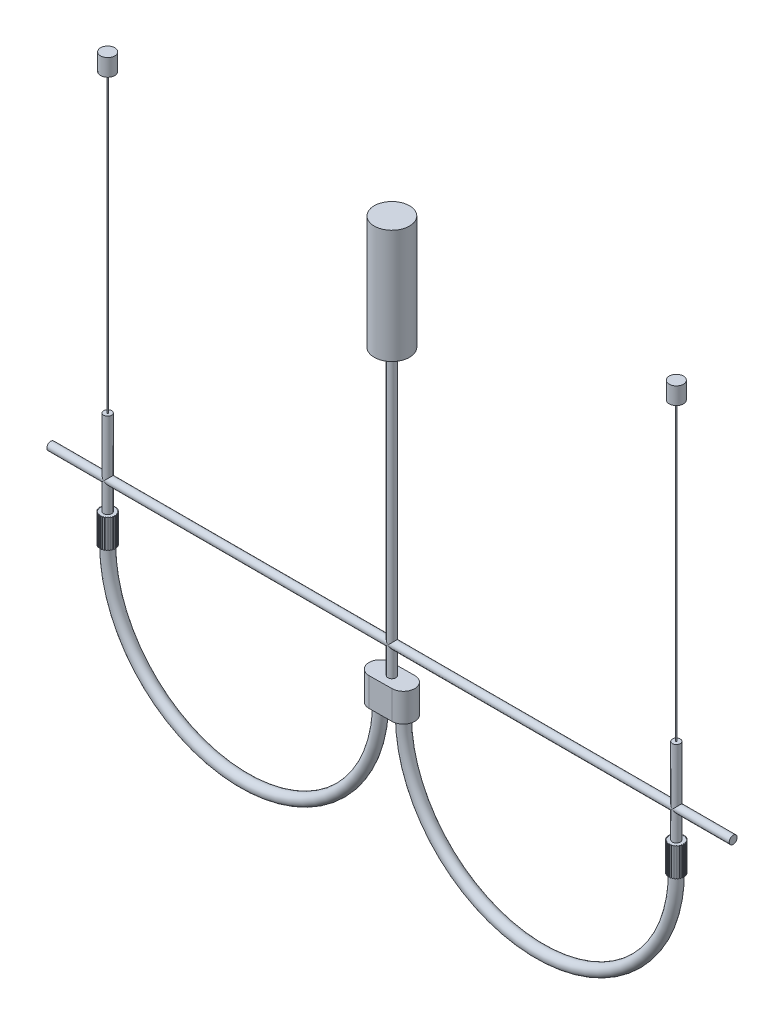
SolidWorks part; units mm, degrees
ref_plane "Alzado" through (0, 0, 0) normal (0, 0, 1) x (1, 0, 0)
ref_plane "Planta" through (0, 0, 0) normal (0, 1, 0) x (1, 0, 0)
ref_plane "Vista lateral" through (0, 0, 0) normal (1, 0, 0) x (0, 0, -1)
sketch "Croquis1" plane through (0, 0, 0) normal (0, 1, 0) x (1, 0, 0)
  circle A0 centre (0, 0) radius 31
  dimension "D1" = 62
extrude "Saliente-Extruir1" add sketch "Croquis1" along normal blind 200
sketch "Croquis2" plane through (0, 0, 0) normal (0, -1, 0) x (1, 0, 0)
  circle A1 centre (0, 0) radius 7
  point P4 (0, 0)
  dimension "D2" = 14
extrude "Saliente-Extruir2" add sketch "Croquis2" along normal blind 500
sketch "Croquis3" plane through (0, -500, 0) normal (0, -1, 0) x (1, 0, 0)
  line L0 (-20, 0.2292) -> (20, -0.2292) construction
  line L1 (-19.7708, 20.2279) -> (20.2292, 19.7695)
  line L2 (-20.2292, -19.7695) -> (19.7708, -20.2279)
  arc A0 (-19.7708, 20.2279) -> (-20.2292, -19.7695) centre (-20, 0.2292) ccw
  arc A1 (19.7708, -20.2279) -> (20.2292, 19.7695) centre (20, -0.2292) ccw
  point P2 (0, 0)
  dimension "D1" = 20
  dimension "D2" = 40
extrude "Saliente-Extruir3" add sketch "Croquis3" along normal blind 50 separate body
sketch "Croquis4" plane through (0, -550, 0) normal (0, -1, 0) x (1, 0, 0)
  line L0 (0, 0) -> (-20, 0) construction
  line L1 (0, 0) -> (20, 0) construction
  circle A0 centre (-20, 0) radius 10
  circle A2 centre (20, 0) radius 10
  dimension "D2" = 20
  dimension "D4" = 20
  dimension "D1" = 20
  dimension "D3" = 20
extrude "Cortar-Extruir1" cut sketch "Croquis4" against normal blind 20
sketch "Croquis5" plane through (0, 0, 0) normal (0, 0, 1) x (1, 0, 0)
  line L0 (-599.7708, -450) -> (600.2292, -450)
  line L1 (0.2292, -500) -> (0.2292, -450) construction
  line L2 (20.2292, -500) -> (-19.7708, -500) construction
  point P3 (0.2292, -450)
  dimension "D1" = 1200
  dimension "D2" = 50
sweep "Barrer1" add path "Croquis5" parameters "D3"=14
ref_plane "Plano1" through (0, -450, 0) normal (0, -1, 0) x (-1, 0, 0)
sketch "Croquis18" plane through (0, -450, 0) normal (0, -1, 0) x (-1, 0, 0)
  line L0 (599.7708, 0) -> (499.7708, 0) construction
  line L1 (599.7708, -7) -> (599.7708, 7) construction
  line L2 (-600.2292, 0) -> (-500.2292, 0) construction
  line L3 (-600.2292, 7) -> (-600.2292, -7) construction
  circle A0 centre (499.7708, 0) radius 7
  circle A1 centre (-500.2292, 0) radius 7
  dimension "D3" = 14
  dimension "D1" = 100
  dimension "D2" = 100
extrude "Saliente-Extruir4" add sketch "Croquis18" along normal blind 50 and the other way blind 100 separate body
sketch "Croquis19" plane through (0, -500, 0) normal (0, -1, 0) x (1, 0, 0)
  circle A0 centre (-499.7708, 0) radius 12.5
  circle A1 centre (500.2292, 0) radius 12.5
  dimension "D1" = 25
  dimension "D2" = 25
extrude "Saliente-Extruir5" add sketch "Croquis19" along normal blind 50 separate body
sketch "Croquis20" plane through (0, 0, 0) normal (0, 0, 1) x (1, 0, 0)
  line L0 (-512.2708, -550) -> (-487.2708, -550) construction
  arc A0 (-499.7708, -550) -> (-19.7708, -550) centre (-259.7708, -550) ccw
sweep "Barrer2" add path "Croquis20" parameters "D3"=20
sketch "Croquis33" plane through (0, 0, 0) normal (0, 0, 1) x (1, 0, 0)
  line L0 (487.7292, -550) -> (512.7292, -550) construction
  arc A0 (20.2292, -550) -> (500.2292, -550) centre (260.2292, -550) ccw
sweep "Barrer3" add path "Croquis33" parameters "D3"=20
sketch "Croquis46" plane through (0, -350, 0) normal (0, 1, 0) x (1, 0, 0)
  circle A0 centre (500.2292, 0) radius 1
  circle A1 centre (-499.7708, 0) radius 1
  dimension "D1" = 2
  dimension "D2" = 2
extrude "Saliente-Extruir6" add sketch "Croquis46" along normal blind 520 separate body
sketch "Croquis47" plane through (0, 170, 0) normal (0, 1, 0) x (1, 0, 0)
  circle A0 centre (500.2292, 0) radius 12.5
  circle A1 centre (-499.7708, 0) radius 12.5
  dimension "D1" = 25
  dimension "D2" = 25
extrude "Saliente-Extruir7" add sketch "Croquis47" along normal blind 30 separate body
sketch "Croquis48" plane through (0, -500, 0) normal (0, 1, 0) x (1, 0, 0)
  line L0 (500.2292, 0) -> (487.7292, 0) construction
  line L1 (486.9046, 2.3887) -> (487.402, 4.3259)
  line L2 (488.7292, -1) -> (486.7292, -1)
  line L3 (488.7292, -1) -> (488.7292, 1)
  line L4 (488.7292, 1) -> (486.7292, 1)
  line L5 (486.7292, -1) -> (486.7292, 1)
  line L6 (488.7292, -1) -> (486.7292, 1) construction
  line L7 (488.7292, 1) -> (486.7292, -1) construction
  line L8 (488.8418, 1.8914) -> (486.9046, 2.3887)
  line L9 (488.8418, 1.8914) -> (489.3392, 3.8285)
  line L10 (489.3392, 3.8285) -> (487.402, 4.3259)
  line L11 (487.9173, 5.6274) -> (488.8808, 7.38)
  line L12 (489.6699, 4.6639) -> (487.9173, 5.6274)
  line L13 (489.6699, 4.6639) -> (490.6334, 6.4165)
  line L14 (490.6334, 6.4165) -> (488.8808, 7.38)
  line L15 (489.7036, 8.5124) -> (491.0727, 9.9704)
  line L16 (491.1615, 7.1433) -> (489.7036, 8.5124)
  line L17 (491.1615, 7.1433) -> (492.5306, 8.6013)
  line L18 (492.5306, 8.6013) -> (491.0727, 9.9704)
  line L19 (492.1512, 10.8626) -> (493.8399, 11.9343)
  line L20 (493.2229, 9.1739) -> (492.1512, 10.8626)
  line L21 (493.2229, 9.1739) -> (494.9115, 10.2456)
  line L22 (494.9115, 10.2456) -> (493.8399, 11.9343)
  line L23 (495.1064, 12.5302) -> (497.0085, 13.1483)
  line L24 (495.7245, 10.6281) -> (495.1064, 12.5302)
  line L25 (495.7245, 10.6281) -> (497.6266, 11.2462)
  line L26 (497.6266, 11.2462) -> (497.0085, 13.1483)
  line L27 (498.3835, 13.4106) -> (500.3796, 13.5362)
  line L28 (498.5091, 11.4145) -> (498.3835, 13.4106)
  line L29 (498.5091, 11.4145) -> (500.5051, 11.5401)
  line L30 (500.5051, 11.5401) -> (500.3796, 13.5362)
  line L31 (501.7766, 13.4483) -> (503.7411, 13.0735)
  line L32 (501.4018, 11.4837) -> (501.7766, 13.4483)
  line L33 (501.4018, 11.4837) -> (503.3664, 11.1089)
  line L34 (503.3664, 11.1089) -> (503.7411, 13.0735)
  line L35 (505.0724, 12.6409) -> (506.8821, 11.7894)
  line L36 (504.2208, 10.8313) -> (505.0724, 12.6409)
  line L37 (504.2208, 10.8313) -> (506.0305, 9.9797)
  line L38 (506.0305, 9.9797) -> (506.8821, 11.7894)
  line L39 (508.0639, 11.0394) -> (509.6049, 9.7645)
  line L40 (506.7891, 9.4983) -> (508.0639, 11.0394)
  line L41 (506.7891, 9.4983) -> (508.3301, 8.2235)
  line L42 (508.3301, 8.2235) -> (509.6049, 9.7645)
  line L43 (510.5632, 8.7441) -> (511.7387, 7.1261)
  line L44 (508.9451, 7.5685) -> (510.5632, 8.7441)
  line L45 (508.9451, 7.5685) -> (510.1207, 5.9505)
  line L46 (510.1207, 5.9505) -> (511.7387, 7.1261)
  line L47 (512.4131, 5.8995) -> (513.1493, 4.0399)
  line L48 (510.5535, 5.1632) -> (512.4131, 5.8995)
  line L49 (510.5535, 5.1632) -> (511.2898, 3.3037)
  line L50 (511.2898, 3.3037) -> (513.1493, 4.0399)
  line L51 (513.4974, 2.6841) -> (513.7481, 0.6999)
  line L52 (511.5132, 2.4334) -> (513.4974, 2.6841)
  line L53 (511.5132, 2.4334) -> (511.7639, 0.4492)
  line L54 (511.7639, 0.4492) -> (513.7481, 0.6999)
  line L55 (513.7481, -0.6999) -> (513.4974, -2.6841)
  line L56 (511.7639, -0.4492) -> (513.7481, -0.6999)
  line L57 (511.7639, -0.4492) -> (511.5132, -2.4334)
  line L58 (511.5132, -2.4334) -> (513.4974, -2.6841)
  line L59 (513.1493, -4.0399) -> (512.4131, -5.8995)
  line L60 (511.2898, -3.3037) -> (513.1493, -4.0399)
  line L61 (511.2898, -3.3037) -> (510.5535, -5.1632)
  line L62 (510.5535, -5.1632) -> (512.4131, -5.8995)
  line L63 (511.7387, -7.1261) -> (510.5632, -8.7441)
  line L64 (510.1207, -5.9505) -> (511.7387, -7.1261)
  line L65 (510.1207, -5.9505) -> (508.9451, -7.5685)
  line L66 (508.9451, -7.5685) -> (510.5632, -8.7441)
  line L67 (509.6049, -9.7645) -> (508.0639, -11.0394)
  line L68 (508.3301, -8.2235) -> (509.6049, -9.7645)
  line L69 (508.3301, -8.2235) -> (506.7891, -9.4983)
  line L70 (506.7891, -9.4983) -> (508.0639, -11.0394)
  line L71 (506.8821, -11.7894) -> (505.0724, -12.6409)
  line L72 (506.0305, -9.9797) -> (506.8821, -11.7894)
  line L73 (506.0305, -9.9797) -> (504.2208, -10.8313)
  line L74 (504.2208, -10.8313) -> (505.0724, -12.6409)
  line L75 (503.7411, -13.0735) -> (501.7766, -13.4483)
  line L76 (503.3664, -11.1089) -> (503.7411, -13.0735)
  line L77 (503.3664, -11.1089) -> (501.4018, -11.4837)
  line L78 (501.4018, -11.4837) -> (501.7766, -13.4483)
  line L79 (500.3796, -13.5362) -> (498.3835, -13.4106)
  line L80 (500.5051, -11.5401) -> (500.3796, -13.5362)
  line L81 (500.5051, -11.5401) -> (498.5091, -11.4145)
  line L82 (498.5091, -11.4145) -> (498.3835, -13.4106)
  line L83 (497.0085, -13.1483) -> (495.1064, -12.5302)
  line L84 (497.6266, -11.2462) -> (497.0085, -13.1483)
  line L85 (497.6266, -11.2462) -> (495.7245, -10.6281)
  line L86 (495.7245, -10.6281) -> (495.1064, -12.5302)
  line L87 (493.8399, -11.9343) -> (492.1512, -10.8626)
  line L88 (494.9115, -10.2456) -> (493.8399, -11.9343)
  line L89 (494.9115, -10.2456) -> (493.2229, -9.1739)
  line L90 (493.2229, -9.1739) -> (492.1512, -10.8626)
  line L91 (491.0727, -9.9704) -> (489.7036, -8.5124)
  line L92 (492.5306, -8.6013) -> (491.0727, -9.9704)
  line L93 (492.5306, -8.6013) -> (491.1615, -7.1433)
  line L94 (491.1615, -7.1433) -> (489.7036, -8.5124)
  line L95 (488.8808, -7.38) -> (487.9173, -5.6274)
  line L96 (490.6334, -6.4165) -> (488.8808, -7.38)
  line L97 (490.6334, -6.4165) -> (489.6699, -4.6639)
  line L98 (489.6699, -4.6639) -> (487.9173, -5.6274)
  line L99 (487.402, -4.3259) -> (486.9046, -2.3887)
  line L100 (489.3392, -3.8285) -> (487.402, -4.3259)
  line L101 (489.3392, -3.8285) -> (488.8418, -1.8914)
  line L102 (488.8418, -1.8914) -> (486.9046, -2.3887)
  circle A0 centre (500.2292, 0) radius 12.5 construction
  point P109 (500.2292, 0)
  dimension "D1" = 2
  dimension "D2" = 2
  dimension "D3" = 25
extrude "Saliente-Extruir8" add sketch "Croquis48" against normal blind 50
sketch "Croquis49" plane through (0, -500, 0) normal (0, 1, 0) x (1, 0, 0)
  line L0 (-499.7708, 0) -> (-512.2708, 0) construction
  line L1 (-513.0954, 2.3887) -> (-512.598, 4.3259)
  line L2 (-511.2708, -1) -> (-513.2708, -1)
  line L3 (-511.2708, -1) -> (-511.2708, 1)
  line L4 (-511.2708, 1) -> (-513.2708, 1)
  line L5 (-513.2708, -1) -> (-513.2708, 1)
  line L6 (-511.2708, -1) -> (-513.2708, 1) construction
  line L7 (-511.2708, 1) -> (-513.2708, -1) construction
  line L8 (-511.1582, 1.8914) -> (-513.0954, 2.3887)
  line L9 (-511.1582, 1.8914) -> (-510.6608, 3.8285)
  line L10 (-510.6608, 3.8285) -> (-512.598, 4.3259)
  line L11 (-512.0827, 5.6274) -> (-511.1192, 7.38)
  line L12 (-510.3301, 4.6639) -> (-512.0827, 5.6274)
  line L13 (-510.3301, 4.6639) -> (-509.3666, 6.4165)
  line L14 (-509.3666, 6.4165) -> (-511.1192, 7.38)
  line L15 (-510.2964, 8.5124) -> (-508.9273, 9.9704)
  line L16 (-508.8385, 7.1433) -> (-510.2964, 8.5124)
  line L17 (-508.8385, 7.1433) -> (-507.4694, 8.6013)
  line L18 (-507.4694, 8.6013) -> (-508.9273, 9.9704)
  line L19 (-507.8488, 10.8626) -> (-506.1601, 11.9343)
  line L20 (-506.7771, 9.1739) -> (-507.8488, 10.8626)
  line L21 (-506.7771, 9.1739) -> (-505.0885, 10.2456)
  line L22 (-505.0885, 10.2456) -> (-506.1601, 11.9343)
  line L23 (-504.8936, 12.5302) -> (-502.9915, 13.1483)
  line L24 (-504.2755, 10.6281) -> (-504.8936, 12.5302)
  line L25 (-504.2755, 10.6281) -> (-502.3734, 11.2462)
  line L26 (-502.3734, 11.2462) -> (-502.9915, 13.1483)
  line L27 (-501.6165, 13.4106) -> (-499.6204, 13.5362)
  line L28 (-501.4909, 11.4145) -> (-501.6165, 13.4106)
  line L29 (-501.4909, 11.4145) -> (-499.4949, 11.5401)
  line L30 (-499.4949, 11.5401) -> (-499.6204, 13.5362)
  line L31 (-498.2234, 13.4483) -> (-496.2589, 13.0735)
  line L32 (-498.5982, 11.4837) -> (-498.2234, 13.4483)
  line L33 (-498.5982, 11.4837) -> (-496.6336, 11.1089)
  line L34 (-496.6336, 11.1089) -> (-496.2589, 13.0735)
  line L35 (-494.9276, 12.6409) -> (-493.1179, 11.7894)
  line L36 (-495.7792, 10.8313) -> (-494.9276, 12.6409)
  line L37 (-495.7792, 10.8313) -> (-493.9695, 9.9797)
  line L38 (-493.9695, 9.9797) -> (-493.1179, 11.7894)
  line L39 (-491.9361, 11.0394) -> (-490.3951, 9.7645)
  line L40 (-493.2109, 9.4983) -> (-491.9361, 11.0394)
  line L41 (-493.2109, 9.4983) -> (-491.6699, 8.2235)
  line L42 (-491.6699, 8.2235) -> (-490.3951, 9.7645)
  line L43 (-489.4368, 8.7441) -> (-488.2613, 7.1261)
  line L44 (-491.0549, 7.5685) -> (-489.4368, 8.7441)
  line L45 (-491.0549, 7.5685) -> (-489.8793, 5.9505)
  line L46 (-489.8793, 5.9505) -> (-488.2613, 7.1261)
  line L47 (-487.5869, 5.8995) -> (-486.8507, 4.0399)
  line L48 (-489.4465, 5.1632) -> (-487.5869, 5.8995)
  line L49 (-489.4465, 5.1632) -> (-488.7102, 3.3037)
  line L50 (-488.7102, 3.3037) -> (-486.8507, 4.0399)
  line L51 (-486.5026, 2.6841) -> (-486.2519, 0.6999)
  line L52 (-488.4868, 2.4334) -> (-486.5026, 2.6841)
  line L53 (-488.4868, 2.4334) -> (-488.2361, 0.4492)
  line L54 (-488.2361, 0.4492) -> (-486.2519, 0.6999)
  line L55 (-486.2519, -0.6999) -> (-486.5026, -2.6841)
  line L56 (-488.2361, -0.4492) -> (-486.2519, -0.6999)
  line L57 (-488.2361, -0.4492) -> (-488.4868, -2.4334)
  line L58 (-488.4868, -2.4334) -> (-486.5026, -2.6841)
  line L59 (-486.8507, -4.0399) -> (-487.5869, -5.8995)
  line L60 (-488.7102, -3.3037) -> (-486.8507, -4.0399)
  line L61 (-488.7102, -3.3037) -> (-489.4465, -5.1632)
  line L62 (-489.4465, -5.1632) -> (-487.5869, -5.8995)
  line L63 (-488.2613, -7.1261) -> (-489.4368, -8.7441)
  line L64 (-489.8793, -5.9505) -> (-488.2613, -7.1261)
  line L65 (-489.8793, -5.9505) -> (-491.0549, -7.5685)
  line L66 (-491.0549, -7.5685) -> (-489.4368, -8.7441)
  line L67 (-490.3951, -9.7645) -> (-491.9361, -11.0394)
  line L68 (-491.6699, -8.2235) -> (-490.3951, -9.7645)
  line L69 (-491.6699, -8.2235) -> (-493.2109, -9.4983)
  line L70 (-493.2109, -9.4983) -> (-491.9361, -11.0394)
  line L71 (-493.1179, -11.7894) -> (-494.9276, -12.6409)
  line L72 (-493.9695, -9.9797) -> (-493.1179, -11.7894)
  line L73 (-493.9695, -9.9797) -> (-495.7792, -10.8313)
  line L74 (-495.7792, -10.8313) -> (-494.9276, -12.6409)
  line L75 (-496.2589, -13.0735) -> (-498.2234, -13.4483)
  line L76 (-496.6336, -11.1089) -> (-496.2589, -13.0735)
  line L77 (-496.6336, -11.1089) -> (-498.5982, -11.4837)
  line L78 (-498.5982, -11.4837) -> (-498.2234, -13.4483)
  line L79 (-499.6204, -13.5362) -> (-501.6165, -13.4106)
  line L80 (-499.4949, -11.5401) -> (-499.6204, -13.5362)
  line L81 (-499.4949, -11.5401) -> (-501.4909, -11.4145)
  line L82 (-501.4909, -11.4145) -> (-501.6165, -13.4106)
  line L83 (-502.9915, -13.1483) -> (-504.8936, -12.5302)
  line L84 (-502.3734, -11.2462) -> (-502.9915, -13.1483)
  line L85 (-502.3734, -11.2462) -> (-504.2755, -10.6281)
  line L86 (-504.2755, -10.6281) -> (-504.8936, -12.5302)
  line L87 (-506.1601, -11.9343) -> (-507.8488, -10.8626)
  line L88 (-505.0885, -10.2456) -> (-506.1601, -11.9343)
  line L89 (-505.0885, -10.2456) -> (-506.7771, -9.1739)
  line L90 (-506.7771, -9.1739) -> (-507.8488, -10.8626)
  line L91 (-508.9273, -9.9704) -> (-510.2964, -8.5124)
  line L92 (-507.4694, -8.6013) -> (-508.9273, -9.9704)
  line L93 (-507.4694, -8.6013) -> (-508.8385, -7.1433)
  line L94 (-508.8385, -7.1433) -> (-510.2964, -8.5124)
  line L95 (-511.1192, -7.38) -> (-512.0827, -5.6274)
  line L96 (-509.3666, -6.4165) -> (-511.1192, -7.38)
  line L97 (-509.3666, -6.4165) -> (-510.3301, -4.6639)
  line L98 (-510.3301, -4.6639) -> (-512.0827, -5.6274)
  line L99 (-512.598, -4.3259) -> (-513.0954, -2.3887)
  line L100 (-510.6608, -3.8285) -> (-512.598, -4.3259)
  line L101 (-510.6608, -3.8285) -> (-511.1582, -1.8914)
  line L102 (-511.1582, -1.8914) -> (-513.0954, -2.3887)
  circle A0 centre (-499.7708, 0) radius 12.5 construction
  point P108 (-499.7708, 0)
  dimension "D1" = 2
  dimension "D2" = 2
  dimension "D3" = 25
extrude "Saliente-Extruir9" add sketch "Croquis49" against normal blind 50
